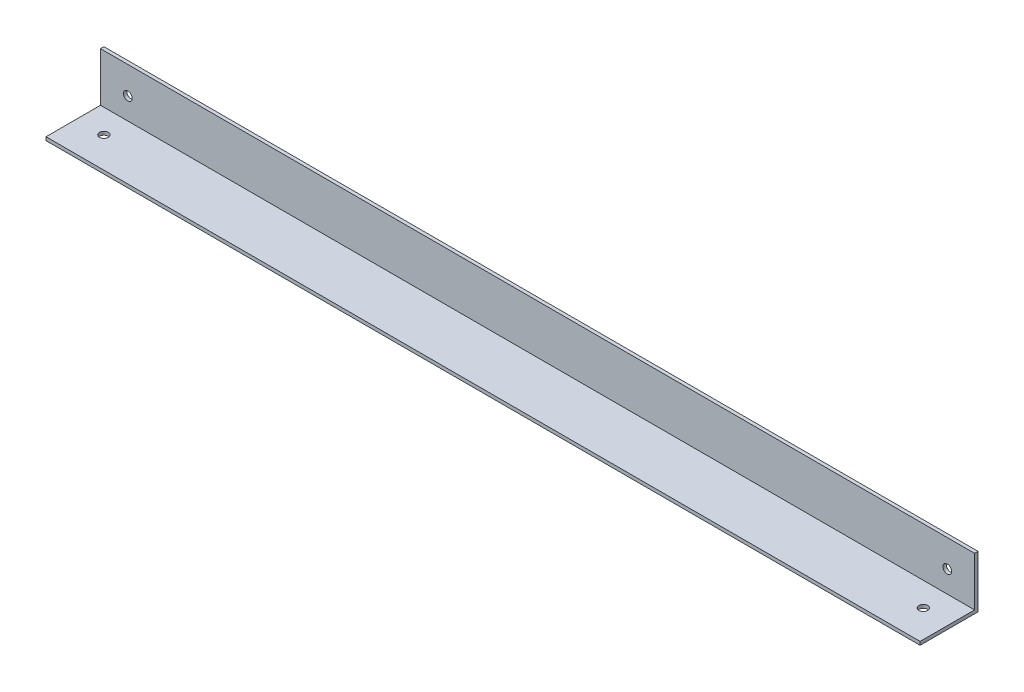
SolidWorks part; units mm, degrees
ref_plane "Front" through (0, 0, 0) normal (0, 0, 1) x (1, 0, 0)
ref_plane "Top" through (0, 0, 0) normal (0, 1, 0) x (1, 0, 0)
ref_plane "Right" through (0, 0, 0) normal (1, 0, 0) x (0, 0, -1)
sketch "Sketch1" plane through (0, 0, 0) normal (0, 0, 1) x (1, 0, 0)
  line L1 (-209.8261, 67.8385) -> (196.5739, 67.8385)
  line L2 (-209.8261, 67.8385) -> (-209.8261, 43.4545)
  line L3 (-209.8261, 43.4545) -> (196.5739, 43.4545)
  line L4 (196.5739, 67.8385) -> (196.5739, 43.4545)
  dimension "D1" = 406.4
  dimension "D2" = 24.384
extrude "Boss-Extrude1" add sketch "Sketch1" along normal blind 26.924
sketch "Sketch2" plane through (0, 67.8385, 0) normal (0, 1, 0) x (1, 0, 0)
  line L0 (-209.8261, -26.924) -> (-209.8261, 0) construction
  line L1 (-209.8261, -1.5875) -> (196.5739, -1.5875)
  line L2 (-209.8261, -1.5875) -> (-209.8261, -26.924)
  line L3 (-209.8261, -26.924) -> (196.5739, -26.924)
  line L4 (196.5739, -1.5875) -> (196.5739, -26.924)
  line L5 (196.5739, 0) -> (-209.8261, 0) construction
  dimension "D1" = 1.5875
extrude "Cut-Extrude1" cut sketch "Sketch2" against normal blind 12.7
sketch "Sketch3" plane through (0, 0, 26.924) normal (0, 0, 1) x (1, 0, 0)
  line L0 (196.5739, 43.4545) -> (196.5739, 55.1385) construction
  line L1 (-209.8261, 55.1385) -> (196.5739, 55.1385)
  line L2 (-209.8261, 55.1385) -> (-209.8261, 45.042)
  line L3 (-209.8261, 45.042) -> (196.5739, 45.042)
  line L4 (196.5739, 55.1385) -> (196.5739, 45.042)
  line L5 (-209.8261, 43.4545) -> (196.5739, 43.4545) construction
  dimension "D1" = 1.5875
extrude "Cut-Extrude3" cut sketch "Sketch3" against normal up to surface (25.3365 mm away)
sketch "Sketch4" plane through (0, 43.4545, 0) normal (0, -1, 0) x (1, 0, 0)
  line L0 (-209.8261, 0) -> (196.5739, 0) construction
  line L1 (-209.8261, 26.924) -> (-209.8261, 0) construction
  line L2 (-6.6261, 26.924) -> (-6.6261, -64.6227) construction
  line L3 (-209.8261, 26.924) -> (196.5739, 26.924) construction
  circle A0 centre (-197.1261, 12.7) radius 2.032
  circle A1 centre (183.8739, 12.7) radius 2.032
  dimension "D1" = 4.064
  dimension "D2" = 12.7
  dimension "D3" = 12.7
sketch "Sketch5" plane through (0, 0, 0) normal (0, 0, -1) x (-1, 0, 0)
  line L0 (6.6261, 77.4225) -> (6.6261, -19.794) construction
  line L1 (-196.5739, 67.8385) -> (209.8261, 67.8385) construction
  line L2 (-196.5739, 43.4545) -> (-196.5739, 67.8385) construction
  circle A0 centre (-183.8739, 55.1385) radius 2.032
  circle A1 centre (197.1261, 55.1385) radius 2.032
  dimension "D3" = 4.064
  dimension "D1" = 12.7
  dimension "D2" = 12.7
extrude "Cut-Extrude4" cut sketch "Sketch4" against normal blind 2.54
extrude "Cut-Extrude5" cut sketch "Sketch5" against normal blind 2.54
equation "\".5n\"=1"
